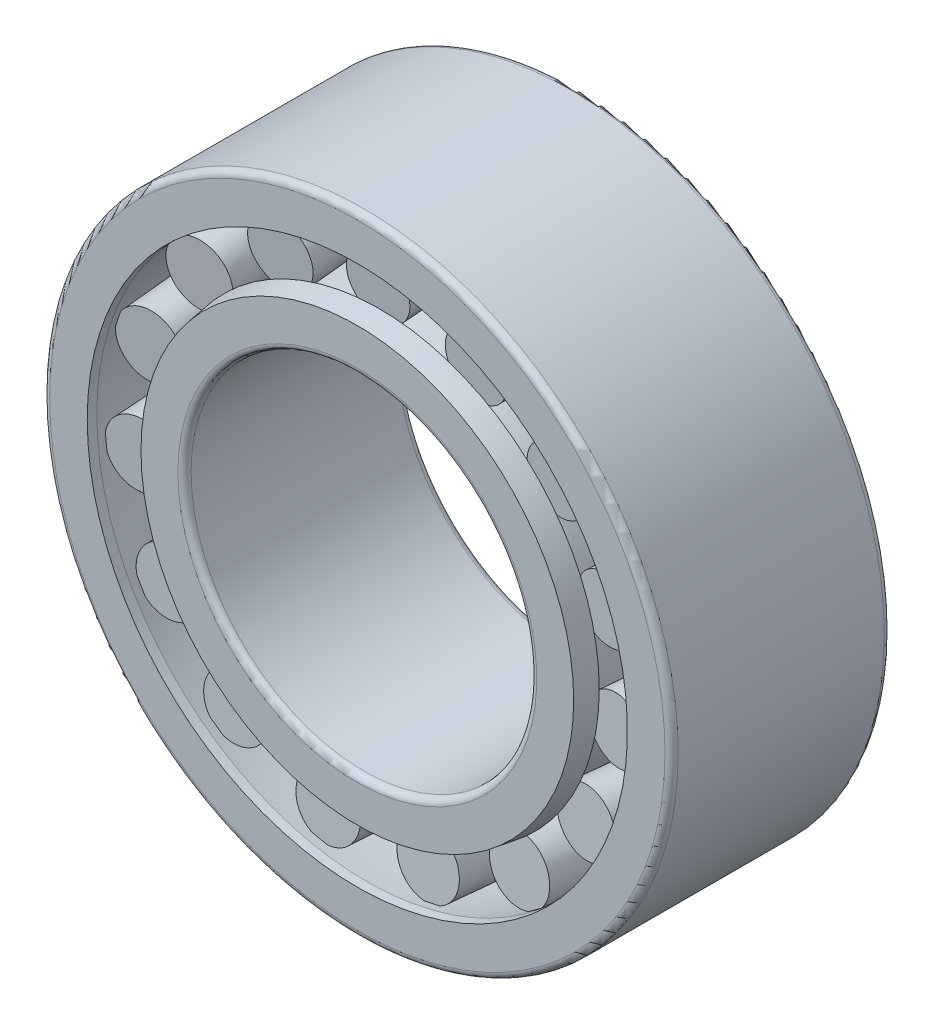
SolidWorks part; units mm, degrees
ref_plane "Front Plane" through (0, 0, 0) normal (0, 0, 1) x (1, 0, 0)
ref_plane "Top Plane" through (0, 0, 0) normal (0, 1, 0) x (1, 0, 0)
ref_plane "Right Plane" through (0, 0, 0) normal (1, 0, 0) x (0, 0, -1)
sketch "BaseSke" plane through (0, 0, 0) normal (1, 0, 0) x (0, 0, -1)
  line L0 (-47.2296, 0) -> (69.4868, 0) construction
  line L2 (0, 129.5214) -> (0, 88.1749) construction
  line L3 (-34.9, 55) -> (-34.9, 68.8462) construction
  line L4 (-34.9, 100) -> (34.9, 100) construction
  line L5 (-34.9, 55) -> (34.9, 55) construction
  line L7 (34.9, 55) -> (34.9, 68.8462) construction
  line L8 (34.9, 85.4615) -> (34.9, 100) construction
  line L9 (-34.9, 85.4615) -> (-34.9, 100) construction
  line L11 (0, 79.975) -> (-34.9, 77.1538) construction
  line L12 (0, 79.975) -> (34.9, 77.1538) construction
  line L13 (-34.9, 85.4615) -> (-34.9, 68.8462) construction
  line L14 (0, 71.775) -> (0, -86.3012) construction
  line L15 (0, 88.1749) -> (0, 71.775) construction
  line L16 (-28.2719, 76.5225) -> (-27.4605, 66.4845) construction
  line L17 (-29.0833, 86.5605) -> (-5.8923, 88.4351)
  line L18 (-29.0833, 86.5605) -> (-28.2719, 76.5225)
  line L19 (-27.4605, 66.4845) -> (-4.2695, 68.3591) construction
  line L20 (-5.8923, 88.4351) -> (-5.0809, 78.3971)
  line L21 (-4.2695, 68.3591) -> (-5.0809, 78.3971) construction
  line L22 (-28.2719, 76.5225) -> (-5.0809, 78.3971)
  line L23 (-34.9, 75.9867) -> (0, 78.8078) construction
  arc A1 (-34.9, 85.4615) -> (34.9, 85.4615) centre (0, -137.625) cw construction
  arc A2 (34.9, 68.8462) -> (-34.9, 68.8462) centre (0, -137.625) ccw construction
  dimension "D2" = 13.8462
  dimension "D1" = 209.4
  dimension "Bearing_Thickness" = 69.8
  dimension "Bearing_Outside_Diameter" = 200
  dimension "Bearing_Inside_Diameter" = 110
  dimension "D3" = 14.5385
  dimension "D4" = 23.2667
  dimension "D5" = 5.8167
  dimension "D6" = 1.1633
revolve "Roller" add sketch "BaseSke" angle 360 about L23
sketch "OuterRaceSke" plane through (0, 0, 0) normal (1, 0, 0) x (0, 0, -1)
  line L0 (0, 0) -> (0, 94.5438) construction
  line L1 (-34.9, 100) -> (34.9, 100)
  line L2 (-34.9, 100) -> (-34.9, 85.4413)
  line L3 (34.9, 100) -> (34.9, 85.4413)
  line L5 (-50.3916, 0) -> (55.2197, 0) construction
  arc A0 (-34.9, 85.4413) -> (34.9, 85.4413) centre (0, -137.625) cw
  arc A2 (34.9, 85.4615) -> (-34.9, 85.4615) centre (0, -137.625) ccw construction
  dimension "D1" = 0.02
revolve "OuterRace" add sketch "OuterRaceSke" angle 360 about L5
sketch "InnerRaceSke" plane through (0, 0, 0) normal (1, 0, 0) x (0, 0, -1)
  line L0 (-70.8626, 0) -> (113.5527, 0) construction
  line L1 (0, 90.393) -> (0, -90.393) construction
  line L2 (-34.9, 55) -> (34.9, 55)
  line L3 (-34.9, 55) -> (-34.9, 68.8462)
  line L4 (-27.8382, 69.9163) -> (-27.5618, 66.4963)
  line L5 (-27.5618, 66.4963) -> (-4.1714, 68.3871)
  line L7 (-4.1714, 68.3871) -> (-4.4415, 71.7279)
  line L8 (-28.2719, 76.5225) -> (-27.4605, 66.4845) construction
  line L9 (4.1714, 68.3871) -> (4.4415, 71.7279)
  line L10 (-4.2695, 68.3591) -> (-5.0809, 78.3971) construction
  line L11 (-27.4605, 66.4845) -> (-4.2695, 68.3591) construction
  line L14 (27.5618, 66.4963) -> (4.1714, 68.3871)
  line L15 (27.8382, 69.9163) -> (27.5618, 66.4963)
  line L16 (34.9, 55) -> (34.9, 68.8462)
  arc A0 (-34.9, 68.8462) -> (-27.8382, 69.9163) centre (0, -137.625) cw
  arc A1 (34.9, 68.8462) -> (-34.9, 68.8462) centre (0, -137.625) ccw construction
  arc A2 (-4.4415, 71.7279) -> (4.4415, 71.7279) centre (0, -137.625) cw
  arc A3 (34.9, 68.8462) -> (27.8382, 69.9163) centre (0, -137.625) ccw
  point P38 (0, 55)
  dimension "D2" = 0.1
  dimension "D1" = 0.02
  dimension "D3" = 0.1
revolve "InnerRace" add sketch "InnerRaceSke" angle 360 about L0
mirror "MirrorRoller" about plane through (0, 0, 0) normal (0, 0, 1) of "Roller"
fillet "Fillet1" radius 2.1 4 edges at (55, 0, 34.9) (100, 0, 34.9) (55, 0, -34.9) (100, 0, -34.9)
sketch "CutGrooveSke" plane through (0, 0, 0) normal (1, 0, 0) x (0, 0, -1)
  line L0 (-51.8407, 0) -> (83.8302, 0) construction
  line L1 (-17.45, -118) -> (-20.94, -118)
  line L2 (-17.45, -118) -> (-17.45, -98)
  line L3 (-17.45, -98) -> (-20.94, -98)
  line L4 (-20.94, -118) -> (-20.94, -98)
  dimension "D1" = 98
  dimension "D2" = 17.45
  dimension "D3" = 3.49
  dimension "D4" = 20
revolve "CutGroove" [suppressed] cut sketch "CutGrooveSke" angle 360 about L0
sketch "TaperSke" plane through (0, 0, 0) normal (1, 0, 0) x (0, 0, -1)
  line L0 (-34.9, 55) -> (34.9, 55)
  line L1 (34.9, 55) -> (34.9, 60.8167)
  line L2 (34.9, 60.8167) -> (-34.9, 55)
  line L7 (-41.2502, 0) -> (40.8606, 0) construction
  dimension "Taper" = 5.8167
revolve "Taper" [suppressed] cut sketch "TaperSke" angle 360 about L7
fillet "Fillet2" [suppressed] radius 2.1
pattern_circular "CirPatternBall" count 15 over 360 about axis through (0, 0, 0) along (0, 0, 1) of "Roller", "MirrorRoller"
sketch "SimplifiedSke" plane through (0, 0, 0) normal (1, 0, 0) x (0, 0, -1)
  line L0 (37.5911, 0) -> (-37.5911, 0) construction
  line L1 (0, 0) -> (0, 96.8272) construction
  line L2 (-27.4605, 66.4845) -> (-4.2695, 68.3591)
  line L3 (-27.4605, 66.4845) -> (-29.0833, 86.5605)
  line L4 (-29.0833, 86.5605) -> (-5.8923, 88.4351)
  line L5 (-4.2695, 68.3591) -> (-5.8923, 88.4351)
  line L7 (4.2695, 68.3591) -> (5.8923, 88.4351)
  line L8 (27.4605, 66.4845) -> (4.2695, 68.3591)
  line L9 (27.4605, 66.4845) -> (29.0833, 86.5605)
  line L10 (29.0833, 86.5605) -> (5.8923, 88.4351)
revolve "Simplified" [suppressed] add sketch "SimplifiedSke" angle 360 about L0
chamfer "Chamfer" distance 2.9083 angle 10 2 edges at (85.4413, 0, -34.9) (85.4413, 0, 34.9)
equation "\"D1@BaseSke\" = \"Bearing_Thickness@BaseSke\"*3"
equation "\"D2@BaseSke\" =  ( \"Bearing_Outside_Diameter@BaseSke\" - \"Bearing_Inside_Diameter@BaseSke\" ) /6.5"
equation "\"D3@BaseSke\" = \"D2@BaseSke\"*1.05"
equation "\"D4@BaseSke\" = \"Bearing_Thickness@BaseSke\"/3"
equation "\"D5@BaseSke\" = \"Bearing_Thickness@BaseSke\"/12"
equation "\"D6@BaseSke\" = \"Bearing_Thickness@BaseSke\"/60"
equation "\"D1@CutGrooveSke\" = \"Bearing_Outside_Diameter@BaseSke\" * 0.49"
equation "\"D2@CutGrooveSke\" = \"Bearing_Thickness@BaseSke\" *0.25"
equation "\"D3@CutGrooveSke\" = \"Bearing_Thickness@BaseSke\"/20"
equation "\"Taper@TaperSke\" = \"Bearing_Thickness@BaseSke\"/12"
equation "\"D1@Fillet2\" = \"Fillet_radius@Fillet1\""
equation "\"D1@CirPatternBall\" =  int(  ( \"Bearing_Outside_Diameter@BaseSke\" + \"Bearing_Inside_Diameter@BaseSke\" )  / 2 *  pi  /  ( \"Bearing_Outside_Diameter@BaseSke\" - \"Bearing_Inside_Diameter@BaseSke\" ) * 2.8 "
equation "\"D1@Chamfer\" = \"Bearing_Thickness@BaseSke\"/24"
